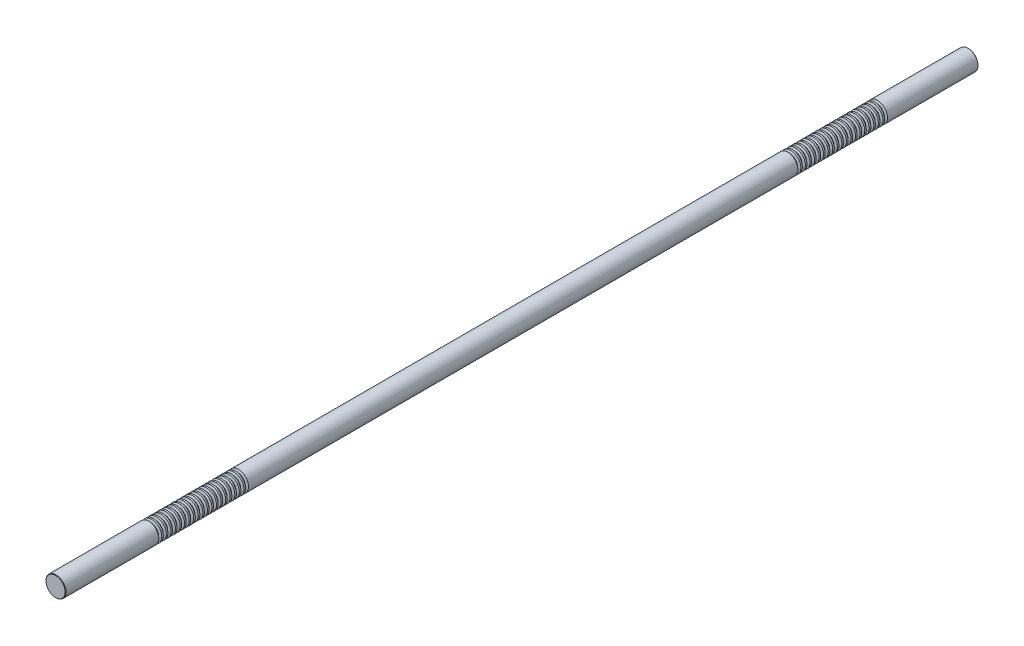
SolidWorks part; units mm, degrees
ref_plane "Front Plane" through (0, 0, 0) normal (0, 0, 1) x (1, 0, 0)
ref_plane "Top Plane" through (0, 0, 0) normal (0, 1, 0) x (1, 0, 0)
ref_plane "Right Plane" through (0, 0, 0) normal (1, 0, 0) x (0, 0, -1)
sketch "Sketch1" plane through (0, 0, 0) normal (0, 0, 1) x (1, 0, 0)
  circle A0 centre (0, 0) radius 11
  dimension "D1" = 22
extrude "Boss-Extrude1" add sketch "Sketch1" along normal mid plane 1000
chamfer "Chamfer1" distance 0.55 angle 45 2 edges at (11, 0, -500) (11, 0, 500)
sketch "Sketch2" plane through (0, 0, 0) normal (1, 0, 0) x (0, 0, -1)
  line L0 (400.3684, 11) -> (397.1316, 11)
  line L1 (499.45, 11) -> (-499.45, 11) construction
  line L2 (397.1316, 11) -> (397.8684, 8.25)
  line L3 (397.8684, 8.25) -> (399.6316, 8.25)
  line L4 (399.6316, 8.25) -> (400.3684, 11)
  line L5 (500, -10.45) -> (500, 10.45) construction
  point P4 (398.75, 11)
  point P7 (398.75, 8.25)
  point P8 (400, 9.625)
  point P9 (397.5, 9.625)
  dimension "D1" = 2.5
  dimension "D2" = 100
  dimension "D3" = 2.75
  dimension "D4" = 30
revolve "Cut-Revolve1" cut sketch "Sketch2" angle 360 about axis through (0, 0, 500) along (0, 0, -1)
pattern_linear "LPattern1" count 20 spacing 5 along (0, 0, 1) of "Cut-Revolve1"
pattern_linear "LPattern2" count 2 spacing 700 along (0, 0, 1) of "Cut-Revolve1", "LPattern1"
